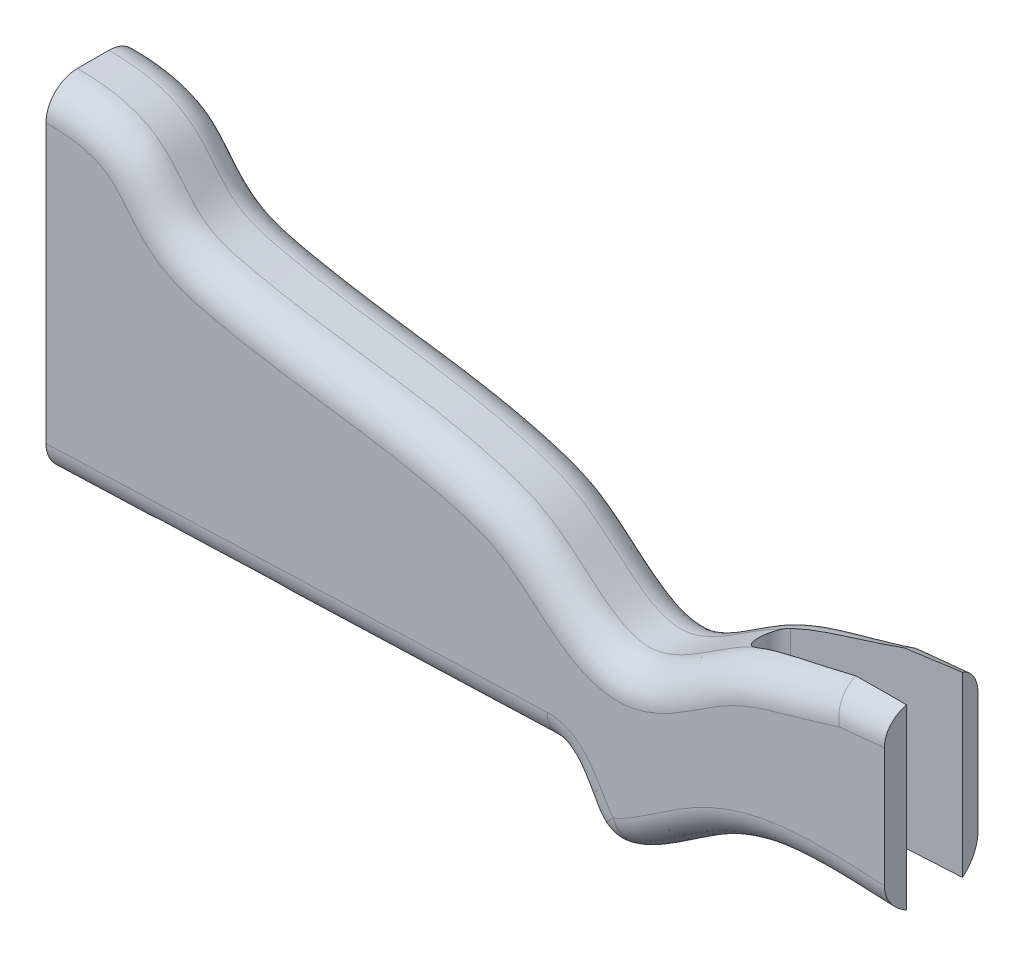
SolidWorks part; units mm, degrees
ref_plane "Front Plane" through (0, 0, 0) normal (0, 0, 1) x (1, 0, 0)
ref_plane "Top Plane" through (0, 0, 0) normal (0, 1, 0) x (1, 0, 0)
ref_plane "Right Plane" through (0, 0, 0) normal (1, 0, 0) x (0, 0, -1)
sketch "Sketch2" plane through (0, 0, 0) normal (0, 0, 1) x (1, 0, 0)
  line L0 (-58.6813, -6.9941) -> (-34.29, 0) construction
  line L1 (-83.693, -30.3094) -> (-83.693, 36.1784) construction
  line L2 (-352.9069, 51.4022) -> (-352.9069, -86.4407)
  line L3 (-11.4747, -71.8062) -> (-11.4747, -8.6066) construction
  line L4 (-149.6267, -79.2186) -> (-352.9069, -86.4407)
  line L5 (-11.4747, -71.8062) -> (-11.4747, 2.2529)
  arc A0 (-58.6813, -6.9941) -> (-77.353, -13.9222) centre (-22.5552, -132.9809) ccw construction
  spline S0 degree 3 poles (-34.4298, -0.0401) (-54.9238, -6.8929) (-81.4384, -10.2687) (-125.8484, -50.2307) (-153.0195, -11.3761) (-207.8031, 7.1702) (-248.4566, 8.1254) (-315.2299, 24.0679) (-312.6062, 51.5601) (-352.9069, 51.4022) knots 0 0 0 0 0.14576 0.274602 0.42464 0.478063 0.772086 0.827955 1 1 1 1
  spline S1 degree 3 poles (-11.4747, -71.8062) (-39.2855, -70.7082) (-73.2201, -67.082) (-115.4763, -104.1343) (-137.9318, -101.2456) (-140.466, -78.9702) (-149.6267, -79.2186) knots 0 0 0 0 0.381594 0.607047 0.668888 1 1 1 1
  spline S2 degree 1 poles (-34.4298, -0.0401) (-11.4747, 2.2529) knots 0 0 1 1
extrude "Boss-Extrude1" add sketch "Sketch2" along normal mid plane 38.1
fillet "Fillet1" radius 12.7 8 edges at (-251.2668, -82.8297, -19.05) (-251.2668, -82.8297, 19.05)
other "Cavity1"
other "RECEIVER 7790640<1>@m75 assembly1"
sketch "Sketch3" plane through (0, 0, 0) normal (0, 0, 1) x (1, 0, 0)
  line L0 (-89.011, -56.0484) -> (-166.5834, -92.221)
  line L1 (-90.9432, -51.9048) -> (-87.0788, -60.1921) construction
  line L2 (-90.7285, -52.3652) -> (-135.6787, -73.3258)
  line L3 (-135.6787, -73.3258) -> (-137.9867, -68.3765)
  line L4 (-137.9867, -68.3765) -> (-170.6543, -83.6097)
  line L5 (-170.6543, -83.6097) -> (-166.6886, -92.1142)
  line L6 (-166.6886, -92.1142) -> (-166.5834, -92.221)
  line L7 (-89.011, -56.0484) -> (-159.6052, -88.967) construction
  line L8 (-90.7285, -52.3652) -> (-161.3227, -85.2838) construction
  line L9 (-90.7285, -52.3652) -> (-89.011, -56.0484)
  dimension "D2" = 9.525
  dimension "D1" = 4.064
revolve "Cut-Revolve1" cut sketch "Sketch3" angle 360 about L0
sketch "Sketch4" plane through (0, 0, 0) normal (0, 1, 0) x (1, 0, 0)
  line L0 (-69.351, 7.3584) -> (-34.3287, 9.8074) construction
  line L1 (-77.353, 6.7988) -> (-9.0475, 11.5752)
  line L2 (0, 0) -> (-76.6134, 0) construction
  line L3 (-77.353, -6.7988) -> (-9.0475, -11.5752)
  line L4 (-9.0475, 11.5752) -> (-9.0475, -11.5752)
  arc A1 (-77.353, 6.7988) -> (-77.353, -6.7988) centre (-76.8776, 0) ccw construction
  arc A2 (-77.353, 6.7988) -> (-77.353, -6.7988) centre (-76.8776, 0) ccw
extrude "Cut-Extrude1" cut sketch "Sketch4" against normal through all both and the other way through all
sketch "Sketch7" plane through (-10.0178, 0, -1.7183) normal (0.9856, 0, 0.1691) x (0.1691, 0, -0.9856)
  line L1 (-12.8857, -71.1142) -> (-21.8831, -71.1142)
  line L2 (-12.8857, -71.1142) -> (-12.8857, 5.1509)
  line L3 (-12.8857, 5.1509) -> (-21.8831, 5.1509)
  line L4 (-21.8831, -71.1142) -> (-21.8831, 5.1509)
extrude "Cut-Extrude3" cut sketch "Sketch7" along normal blind 2.54
sketch "Sketch8" plane through (-10.0014, 0, 1.8117) normal (0.984, 0, -0.1782) x (-0.1782, 0, -0.984)
  line L1 (13.3676, -70.7468) -> (23.8602, -70.7468)
  line L2 (13.3676, -70.7468) -> (13.3676, 2.5292)
  line L3 (13.3676, 2.5292) -> (23.8602, 2.5292)
  line L4 (23.8602, -70.7468) -> (23.8602, 2.5292)
extrude "Cut-Extrude4" cut sketch "Sketch8" along normal blind 2.54
sketch "Sketch9" plane through (0, 0, 0) normal (0, 0, 1) x (1, 0, 0)
  line L0 (-149.6267, -79.2186) -> (-352.9069, -86.4407) construction
  line L4 (-284.8592, -84.0231) -> (-284.8592, -71.3151) construction
  line L5 (-352.9069, -73.7327) -> (-150.0243, -66.5247) construction
  line L7 (-240.5637, -102.7822) -> (-328.519, -105.9071)
  line L8 (-149.807, -74.1418) -> (-353.0872, -81.3639)
  line L9 (-264.3111, -78.2099) -> (-306.5752, -79.7115)
  line L10 (-328.519, -105.9071) -> (-328.6092, -103.3687)
  line L11 (-240.5637, -102.7822) -> (-240.6538, -100.2438)
  line L12 (-149.807, -74.1418) -> (-353.0872, -81.3639) construction
  line L13 (-148.9052, -99.5258) -> (-352.1854, -106.7479) construction
  arc A0 (-240.6538, -100.2438) -> (-264.3111, -78.2099) centre (-263.4994, -101.0555) ccw
  arc A1 (-328.6092, -103.3687) -> (-306.5752, -79.7115) centre (-305.7636, -102.5571) cw
  dimension "D3" = 22.86
  dimension "D1" = 5.08
  dimension "D2" = 25.4
extrude "Cut-Extrude5" cut sketch "Sketch9" against normal through all both and the other way through all
sketch "Sketch10" plane through (2.4419, -68.7327, 0) normal (0.0355, -0.9994, 0) x (0.9994, 0.0355, 0)
  circle A0 centre (-304.3869, 0) radius 2.032
  circle A1 centre (-276.1929, 0) radius 2.032
  dimension "D1" = 4.064
extrude "Cut-Extrude6" cut sketch "Sketch10" against normal blind 19.05
sketch "Sketch11" plane through (-139.5311, -65.0644, 0) normal (-0.9063, -0.4226, 0) x (0, 0, 1)
  circle A0 centre (0, -13.1794) radius 4.064 construction
  circle A1 centre (0, -13.1794) radius 4.064
extrude "Cut-Extrude7" cut sketch "Sketch11" against normal through all
sketch "Sketch12" plane through (-352.9069, 0, 0) normal (-1, 0, 0) x (0, 0, 1)
  circle A0 centre (0, -69.85) radius 2.413 construction
  circle A1 centre (0, 34.925) radius 2.413 construction
  circle A2 centre (0, -69.85) radius 2.413
  circle A3 centre (0, 34.925) radius 2.413
extrude "Cut-Extrude8" cut sketch "Sketch12" against normal blind 25.4
